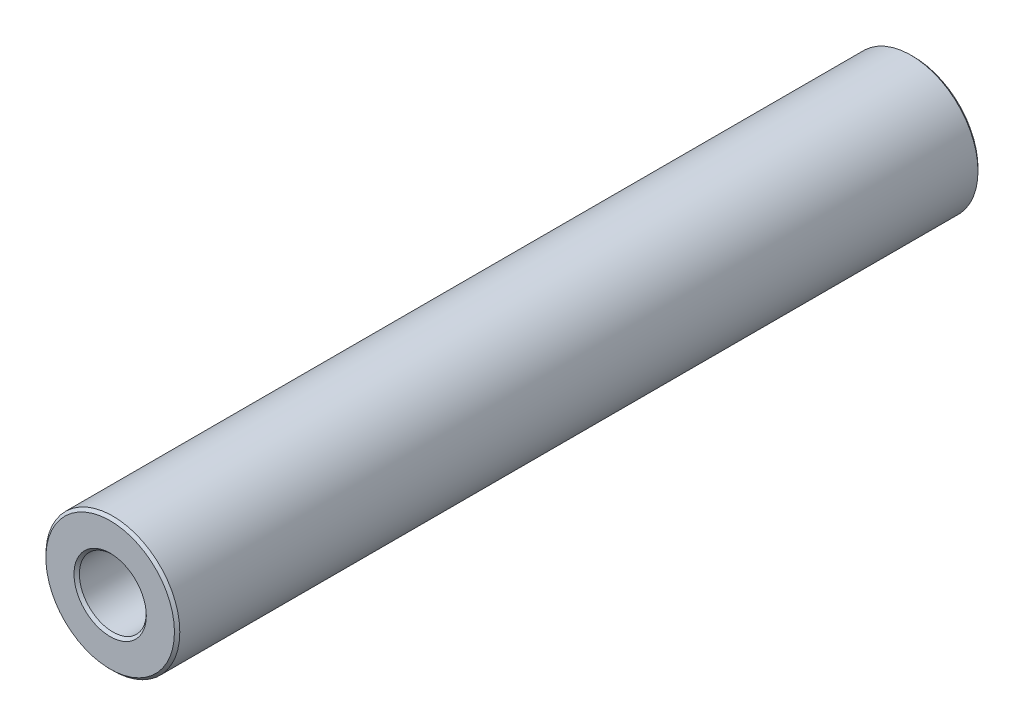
SolidWorks part; units mm, degrees
ref_plane "Front Plane" through (0, 0, 0) normal (0, 0, 1) x (1, 0, 0)
ref_plane "Top Plane" through (0, 0, 0) normal (0, 1, 0) x (1, 0, 0)
ref_plane "Right Plane" through (0, 0, 0) normal (1, 0, 0) x (0, 0, -1)
sketch "Sketch1" plane through (0, 0, 0) normal (0, 0, 1) x (1, 0, 0)
  circle A0 centre (0, 0) radius 2.5
  circle A1 centre (0, 0) radius 1.25
  dimension "D1" = 5
  dimension "D2" = 2.5
extrude "Boss-Extrude2" add sketch "Sketch1" along normal mid plane 30
chamfer "Chamfer3" distance 0.1 angle 45 4 edges at (2.5, 0, 15) (2.5, 0, -15) (1.25, 0, -15) (1.25, 0, 15)
